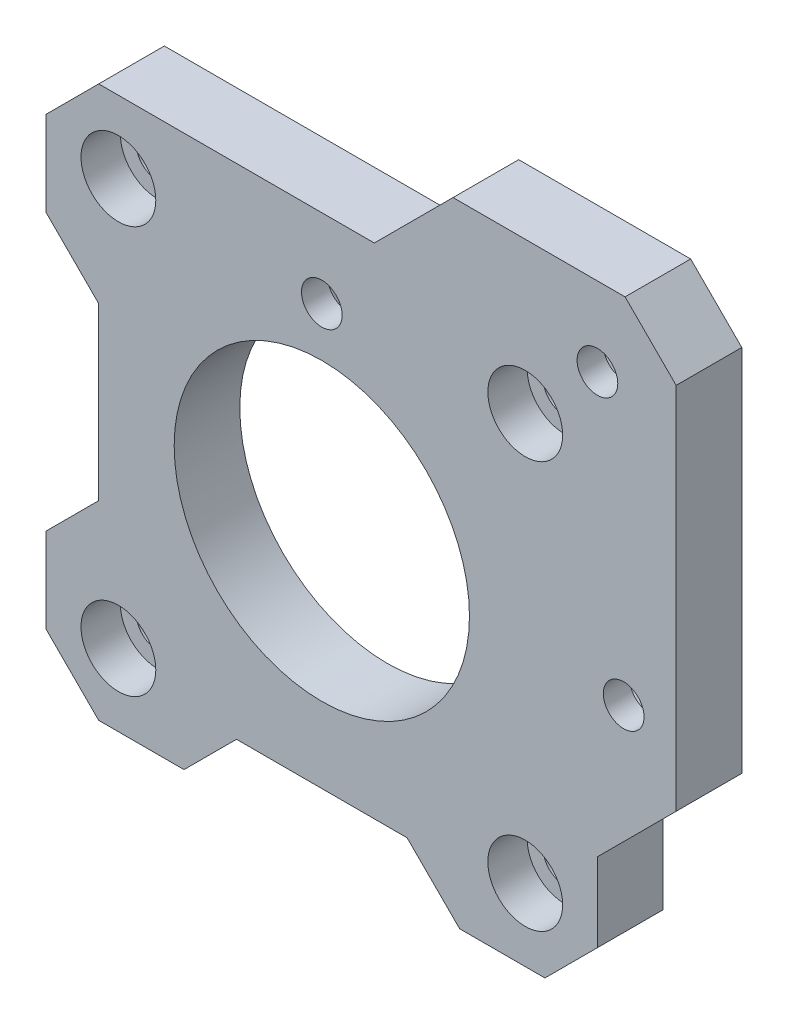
SolidWorks part; units mm, degrees
ref_plane "Спереди" through (0, 0, 0) normal (0, 0, 1) x (1, 0, 0)
ref_plane "Сверху" through (0, 0, 0) normal (0, 1, 0) x (1, 0, 0)
ref_plane "Справа" through (0, 0, 0) normal (1, 0, 0) x (0, 0, -1)
sketch "Эскиз1" plane through (0, 0, 0) normal (0, 0, 1) x (1, 0, 0)
  line L0 (21, -11) -> (27, -5)
  line L1 (-21, -21) -> (21, -21)
  line L2 (-21, -21) -> (-21, 21)
  line L3 (-21, 21) -> (4, 21)
  line L4 (21, -21) -> (21, -11)
  line L5 (-21, -21) -> (25.0533, 25.0533) construction
  line L6 (-21, 21) -> (21, -21) construction
  line L7 (27, -5) -> (27, 23.1066)
  line L8 (27, 23.1066) -> (23.1066, 27)
  line L9 (0, 33.4974) -> (0, 0) construction
  line L10 (23.1066, 27) -> (10, 27)
  line L11 (10, 27) -> (4, 21)
  line L12 (0, 0) -> (42.1792, 0) construction
  point P0 (0, 0)
  dimension "D1" = 42
  dimension "D2" = 6
  dimension "D3" = 6
  dimension "D4" = 10
  dimension "D5" = 25
extrude "Бобышка-Вытянуть1" add sketch "Эскиз1" along normal blind 5
chamfer "Фаска1" distance 4 angle 45 3 edges at (-21, -21, 2.5) (21, -21, 2.5) (-21, 21, 2.5)
sketch "Эскиз2" plane through (0, 0, 5) normal (0, 0, 1) x (1, 0, 0)
  circle A0 centre (0, 0) radius 11.25
  dimension "D1" = 22.5
extrude "Вырез-Вытянуть1" cut sketch "Эскиз2" against normal through all
sketch "Эскиз3" plane through (0, 0, 5) normal (0, 0, 1) x (1, 0, 0)
  line L1 (-15.5, -15.5) -> (15.5, -15.5) construction
  line L2 (-15.5, -15.5) -> (-15.5, 15.5) construction
  line L3 (-15.5, 15.5) -> (15.5, 15.5) construction
  line L4 (15.5, -15.5) -> (15.5, 15.5) construction
  line L5 (-15.5, -15.5) -> (15.5, 15.5) construction
  line L6 (-15.5, 15.5) -> (15.5, -15.5) construction
  circle A0 centre (-15.5, 15.5) radius 1.65
  circle A1 centre (15.5, 15.5) radius 1.65
  circle A2 centre (-15.5, -15.5) radius 1.65
  circle A3 centre (15.5, -15.5) radius 1.65
  point P0 (0, 0)
  dimension "D2" = 3.3
  dimension "D1" = 31
extrude "Вырез-Вытянуть2" cut sketch "Эскиз3" against normal through all
sketch "Эскиз8" plane through (0, 0, 5) normal (0, 0, 1) x (1, 0, 0)
  line L0 (0, 22.8888) -> (0, 0) construction
  circle A0 centre (0, 15) radius 1.55
  dimension "D1" = 15
  dimension "D2" = 3.1
extrude "Вырез-Вытянуть6" cut sketch "Эскиз8" against normal through all
sketch "Эскиз9" plane through (0, 0, 5) normal (0, 0, 1) x (1, 0, 0)
  line L0 (25.0533, 25.0533) -> (21, 21) construction
  line L1 (27, 23.1066) -> (23.1066, 27) construction
  line L2 (0, 28.7817) -> (0, 0) construction
  line L3 (0, 0) -> (37.2192, 0) construction
  circle A0 centre (21, 21) radius 1.55
  dimension "D1" = 3.1
  dimension "D2" = 21
extrude "Вырез-Вытянуть7" cut sketch "Эскиз9" against normal through all
sketch "Эскиз10" plane through (0, 0, 5) normal (0, 0, 1) x (1, 0, 0)
  line L0 (0, 0) -> (23, 0) construction
  circle A0 centre (23, 0) radius 1.55
  dimension "D2" = 3.1
  dimension "D1" = 23
extrude "Вырез-Вытянуть8" cut sketch "Эскиз10" against normal through all
sketch "Эскиз11" plane through (0, 0, 5) normal (0, 0, 1) x (1, 0, 0)
  circle A0 centre (-15.5, -15.5) radius 2.85
  circle A1 centre (15.5, -15.5) radius 2.85
  circle A2 centre (-15.5, 15.5) radius 2.85
  circle A3 centre (15.5, 15.5) radius 2.85
  dimension "D1" = 5.7
extrude "Вырез-Вытянуть9" cut sketch "Эскиз11" against normal blind 3
sketch "Эскиз12" plane through (0, 0, 5) normal (0, 0, 1) x (1, 0, 0)
  line L0 (0, 0) -> (0, -21) construction
  line L1 (-17, -21) -> (17, -21) construction
  line L2 (-10.5, -21) -> (-6.5, -17)
  line L3 (-6.5, -17) -> (6.5, -17)
  line L4 (-10.5, -21) -> (10.5, -21)
  line L5 (-17, 21) -> (-21, 17) construction
  line L6 (10.5, -21) -> (6.5, -17)
  line L7 (0, 0) -> (-19, -19) construction
  line L8 (-21, -17) -> (-17, -21) construction
  line L9 (-21, 10.5) -> (-17, 6.5)
  line L10 (-21, -10.5) -> (-21, 10.5)
  line L11 (-17, -6.5) -> (-17, 6.5)
  line L12 (-21, -10.5) -> (-17, -6.5)
  point P13 (0, -17)
  point P20 (-17, 0)
  dimension "D1" = 21
extrude "Вырез-Вытянуть10" cut sketch "Эскиз12" against normal through all
sketch "Эскиз13" plane through (0, 0, 0) normal (0, 0, -1) x (-1, 0, 0)
  line L0 (-27, 23.1066) -> (-23.1066, 27) construction
  line L1 (-20.1483, 17.8212) -> (-17.8212, 20.1483)
  line L2 (-17.8212, 20.1483) -> (-18.673, 23.327)
  line L3 (-18.673, 23.327) -> (-21.8517, 24.1788)
  line L4 (-21.8517, 24.1788) -> (-24.1788, 21.8517)
  line L5 (-24.1788, 21.8517) -> (-23.327, 18.673)
  line L6 (-23.327, 18.673) -> (-20.1483, 17.8212)
  line L7 (-20.15, -1.6454) -> (-20.15, 1.6454)
  line L8 (-20.15, 1.6454) -> (-23, 3.2909)
  line L9 (-23, 3.2909) -> (-25.85, 1.6454)
  line L10 (-25.85, 1.6454) -> (-25.85, -1.6454)
  line L11 (-25.85, -1.6454) -> (-23, -3.2909)
  line L12 (-23, -3.2909) -> (-20.15, -1.6454)
  line L13 (-1.6454, 12.15) -> (1.6454, 12.15)
  line L14 (1.6454, 12.15) -> (3.2909, 15)
  line L15 (3.2909, 15) -> (1.6454, 17.85)
  line L16 (1.6454, 17.85) -> (-1.6454, 17.85)
  line L17 (-1.6454, 17.85) -> (-3.2909, 15)
  line L18 (-3.2909, 15) -> (-1.6454, 12.15)
  circle A0 centre (-21, 21) radius 2.85 construction
  circle A1 centre (-23, 0) radius 2.85 construction
  circle A2 centre (0, 15) radius 2.85 construction
  dimension "D1" = 5.7
extrude "Вырез-Вытянуть11" cut sketch "Эскиз13" against normal blind 3
sketch "Эскиз15" plane through (0, 0, 5) normal (0, 0, 1) x (1, 0, 0)
  line L0 (-6.5, -17) -> (-10.5, -21) construction
  line L1 (6.5, -17) -> (-6.5, -17) construction
  line L2 (10.5, -21) -> (6.5, -17) construction
  line L3 (-6.5, -17) -> (-10.5, -21)
  line L4 (6.5, -17) -> (-6.5, -17)
  line L5 (10.5, -21) -> (6.5, -17)
  line L6 (-10.5, -21) -> (-10.5, -29)
  line L7 (-10.5, -29) -> (10.5, -29)
  line L8 (10.5, -29) -> (10.5, -21)
  line L9 (0, 0) -> (0, -30.8622) construction
  line L10 (-17, -21) -> (-10.5, -21) construction
  circle A0 centre (-5, -25) radius 1.55
  circle A1 centre (5, -25) radius 1.55
  dimension "D1" = 10
  dimension "D2" = 3.1
  dimension "D4" = 4
  dimension "D3" = 8
extrude "Бобышка-Вытянуть2" [suppressed] add sketch "Эскиз15" against normal up to surface (5 mm away)
chamfer "Фаска2" [suppressed] distance 5 angle 45
sketch "Эскиз16" [suppressed] plane through (0, 0, 5) normal (0, 0, 1) x (1, 0, 0)
  line L0 (-7.85, -25) -> (-7.85, -29)
  line L1 (-10.5, -29) -> (10.5, -29) construction
  line L2 (-7.85, -29) -> (-2.15, -29)
  line L3 (-2.15, -29) -> (-2.15, -25)
  line L4 (0, 0) -> (0, -34.8734) construction
  line L5 (2.15, -29) -> (2.15, -25)
  line L6 (7.85, -29) -> (2.15, -29)
  line L7 (7.85, -25) -> (7.85, -29)
  arc A0 (-2.15, -25) -> (-7.85, -25) centre (-5, -25) ccw
  arc A1 (2.15, -25) -> (7.85, -25) centre (5, -25) cw
  dimension "D1" = 5.7
extrude "Вырез-Вытянуть13" [suppressed] cut sketch "Эскиз16" against normal blind 3
